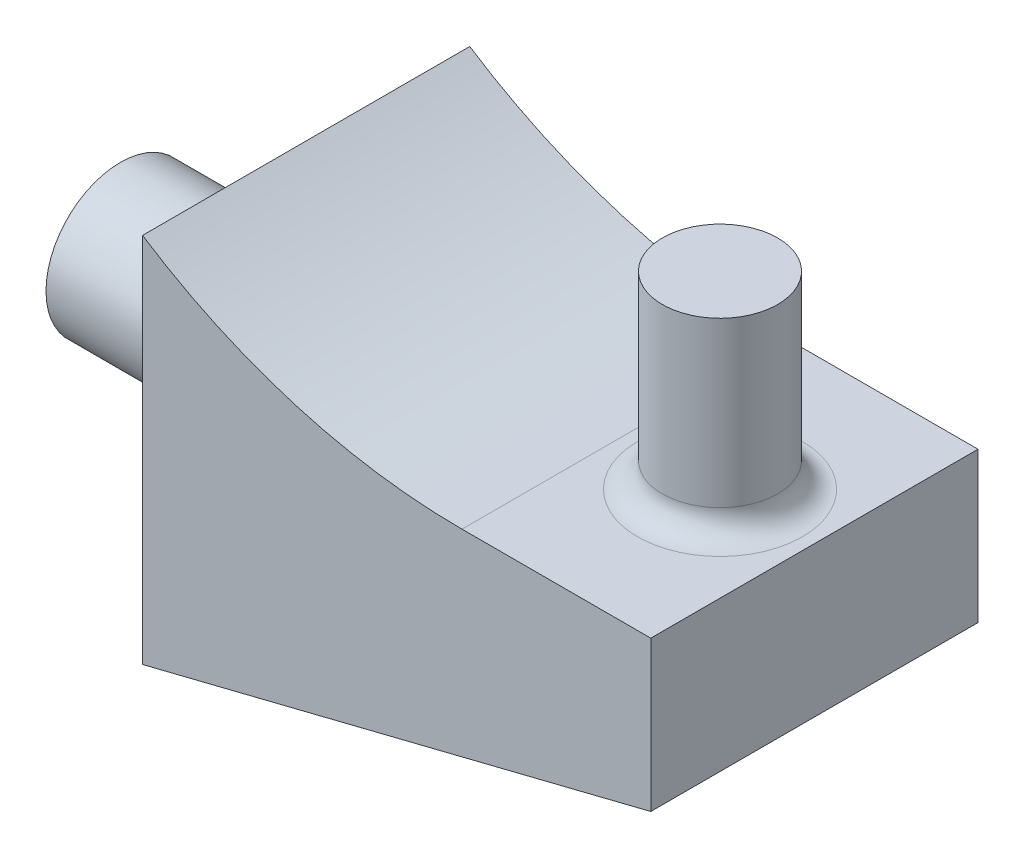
SolidWorks part; units mm, degrees
ref_plane "Front Plane" through (0, 0, 0) normal (0, 0, 1) x (1, 0, 0)
ref_plane "Top Plane" through (0, 0, 0) normal (0, 1, 0) x (1, 0, 0)
ref_plane "Right Plane" through (0, 0, 0) normal (1, 0, 0) x (0, 0, -1)
sketch "Sketch4" plane through (0, 0, 0) normal (0, 0, 1) x (1, 0, 0)
  line L0 (253.4053, 274.9854) -> (253.4053, 244.9854)
  line L1 (253.4053, 244.9854) -> (294.4367, 255.2217)
  line L2 (294.4367, 255.2217) -> (294.4367, 267.3435)
  line L3 (294.4367, 267.3435) -> (279.1967, 267.3435)
  arc A0 (279.1967, 267.3435) -> (253.4053, 274.9854) centre (279.1967, 314.6873) cw
  dimension "D3" = 47.3438
  dimension "D1" = 30
  dimension "D2" = 41.0314
  dimension "D4" = 12.1218
  dimension "D5" = 15.24
extrude "Boss-Extrude1" add sketch "Sketch4" along normal blind 26.416
sketch "Sketch5" plane through (0, 267.3435, 0) normal (0, 1, 0) x (1, 0, 0)
  line L0 (294.4367, -13.208) -> (279.1967, -13.208) construction
  line L1 (294.4367, -26.416) -> (294.4367, 0) construction
  line L2 (279.1967, -26.416) -> (279.1967, 0) construction
  circle A0 centre (286.8167, -13.208) radius 4.6566
  dimension "D1" = 9.3131
extrude "Boss-Extrude2" add sketch "Sketch5" along normal blind 15.24
sketch "Sketch6" plane through (253.4053, 0, 0) normal (-1, 0, 0) x (0, 0, 1)
  line L5 (26.416, 259.9854) -> (0, 259.9854) construction
  circle A0 centre (13.208, 259.9854) radius 6
  dimension "D1" = 12
extrude "Boss-Extrude3" add sketch "Sketch6" along normal blind 15
fillet "Fillet1" radius 2 1 edges at (253.4053, 259.9854, 19.208)
fillet "Fillet2" radius 2 1 edges at (286.8167, 267.3435, 8.5514)
